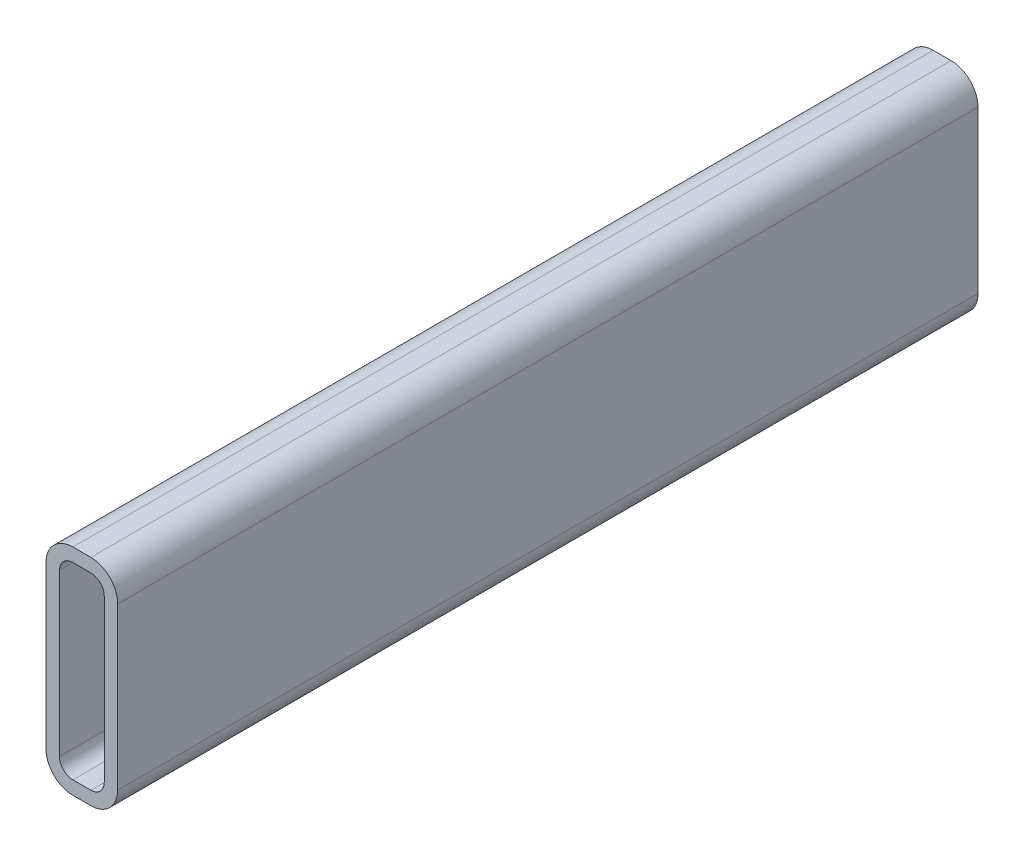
SolidWorks part; units mm, degrees
ref_plane "Front Plane" through (0, 0, 0) normal (0, 0, 1) x (1, 0, 0)
ref_plane "Top Plane" through (0, 0, 0) normal (0, 1, 0) x (1, 0, 0)
ref_plane "Right Plane" through (0, 0, 0) normal (1, 0, 0) x (0, 0, -1)
sketch "Sketch1" plane through (0, 0, 0) normal (0, 0, 1) x (1, 0, 0)
  line B0 (9.525, 76.2) -> (15.875, 76.2)
  arc B1 (25.4, 66.675) -> (15.875, 76.2) centre (15.875, 66.675) ccw
  line B2 (25.4, 66.675) -> (25.4, 9.525)
  arc B3 (15.875, 0) -> (25.4, 9.525) centre (15.875, 9.525) ccw
  line B4 (15.875, 0) -> (9.525, 0)
  arc B5 (0, 9.525) -> (9.525, 0) centre (9.525, 9.525) ccw
  line B6 (0, 9.525) -> (0, 66.675)
  arc B7 (9.525, 76.2) -> (0, 66.675) centre (9.525, 66.675) ccw
  line B8 (9.525, 71.4375) -> (15.875, 71.4375)
  arc B9 (20.6375, 66.675) -> (15.875, 71.4375) centre (15.875, 66.675) ccw
  line B10 (20.6375, 66.675) -> (20.6375, 9.525)
  arc B11 (15.875, 4.7625) -> (20.6375, 9.525) centre (15.875, 9.525) ccw
  line B12 (15.875, 4.7625) -> (9.525, 4.7625)
  arc B13 (4.7625, 9.525) -> (9.525, 4.7625) centre (9.525, 9.525) ccw
  line B14 (4.7625, 9.525) -> (4.7625, 66.675)
  arc B15 (9.525, 71.4375) -> (4.7625, 66.675) centre (9.525, 66.675) ccw
sketch_block_instance "HSS3x1x0.1875-1"
sketch_block "HSS3x1x0.1875"
extrude "Boss-Extrude1" add sketch "Sketch1" along normal blind 304.8
